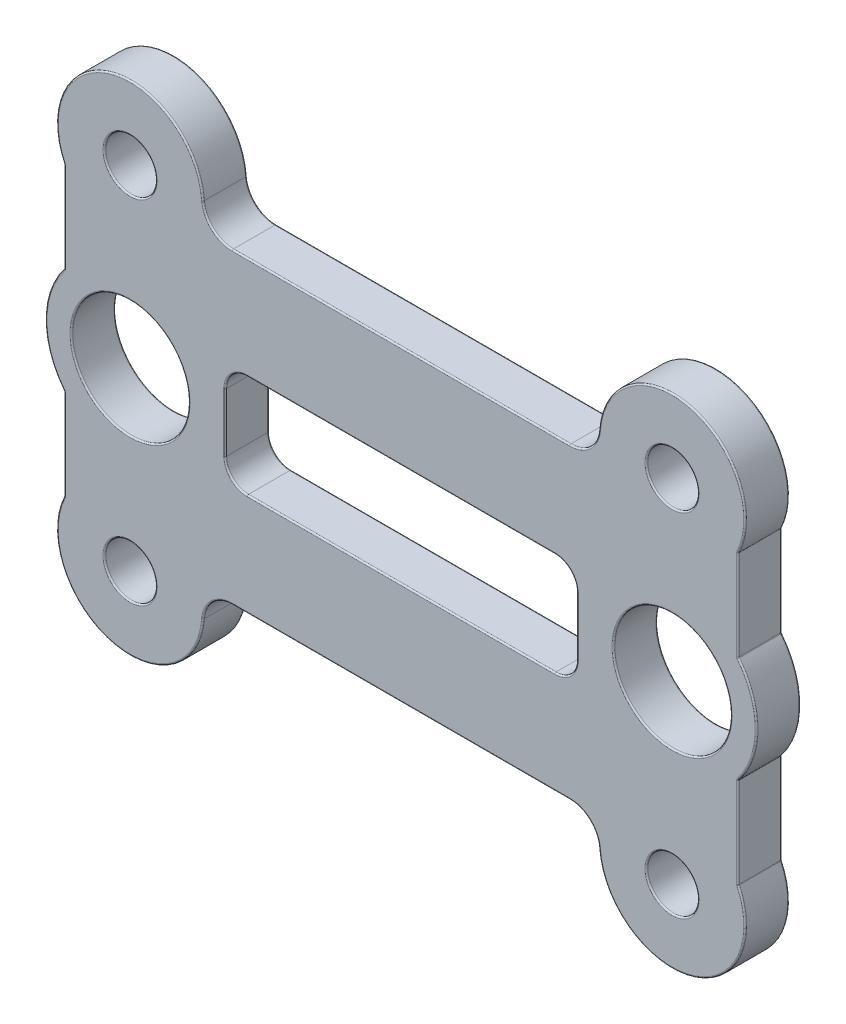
SolidWorks part; units mm, degrees
ref_plane "Plan1" through (0, 0, 0) normal (0, 0, 1) x (1, 0, 0)
ref_plane "Plan2" through (0, 0, 0) normal (0, 1, 0) x (1, 0, 0)
ref_plane "Plan3" through (0, 0, 0) normal (1, 0, 0) x (0, 0, -1)
sketch "Esquisse1" plane through (0, 0, 0) normal (0, 0, 1) x (1, 0, 0)
  line L0 (0, 2.0039) -> (0, 42.0818) construction
  line L1 (-13.7303, 10.5) -> (13.7303, 10.5)
  line L2 (-23, 9.8206) -> (-23, 0)
  line L3 (23, 9.8206) -> (23, 0)
  line L4 (-23, 0) -> (23, 0)
  arc A0 (-13.7303, 10.5) -> (-23, 9.8206) centre (-18.5, 12) ccw
  arc A1 (13.7303, 10.5) -> (23, 9.8206) centre (18.5, 12) cw
  circle A2 centre (-18.5, 12) radius 1.75
  circle A3 centre (18.5, 12) radius 1.75
  point P12 (0, 12)
  point P13 (0, 10.5)
  dimension "D3" = 3.5
  dimension "D4" = 10
  dimension "D1" = 37
  dimension "D2" = 12
  dimension "D5" = 10.5
  dimension "D6" = 23
extrude "Extrusion1" add sketch "Esquisse1" along normal blind 3
mirror "Symétrie1"
sketch "Esquisse2" plane through (0, 0, 3) normal (0, 0, 1) x (1, 0, 0)
  line L0 (0, 0) -> (0, 14.2862) construction
  circle A0 centre (-18.5, 0) radius 5.774
  circle A1 centre (18.5, 0) radius 5.774
  dimension "D1" = 37
extrude "Extrusion2" add sketch "Esquisse2" against normal up to surface (3 mm away)
sketch "Esquisse3" plane through (0, 0, 3) normal (0, 0, 1) x (1, 0, 0)
  line L1 (-12, 3.5) -> (12, 3.5)
  line L2 (-12, 3.5) -> (-12, -3.5)
  line L3 (-12, -3.5) -> (12, -3.5)
  line L4 (12, 3.5) -> (12, -3.5)
  circle A0 centre (18.5, 0) radius 4
  circle A1 centre (-18.5, 0) radius 4
  dimension "D1" = 8
  dimension "D2" = 8
  dimension "D3" = 24
  dimension "D4" = 12
  dimension "D5" = 7
  dimension "D6" = 3.5
extrude "Enlèv. mat.-Extru.1" cut sketch "Esquisse3" against normal through all
fillet "Congé1" radius 2
fillet "Congé2" radius 1.5
fillet "Congé3" radius 0.1
